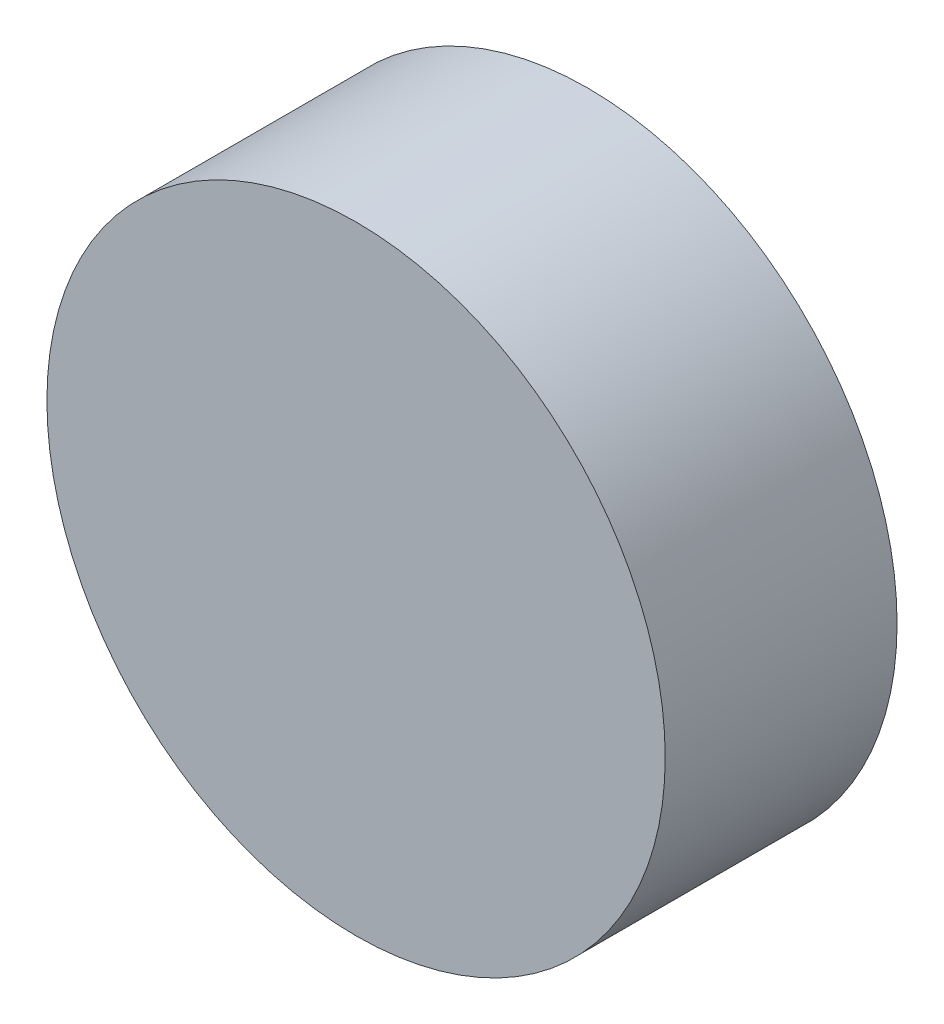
SolidWorks part; units mm, degrees
ref_plane "前视基准面" through (0, 0, 0) normal (0, 0, 1) x (1, 0, 0)
ref_plane "上视基准面" through (0, 0, 0) normal (0, 1, 0) x (1, 0, 0)
ref_plane "右视基准面" through (0, 0, 0) normal (1, 0, 0) x (0, 0, -1)
other "Configuration Table"
sketch "草图1" plane through (0, 0, 0) normal (0, 0, 1) x (1, 0, 0)
  circle A0 centre (0, 0) radius 8
  dimension "D1" = 16
extrude "Foot_envelope" add sketch "草图1" along normal blind 6 from offset 6
